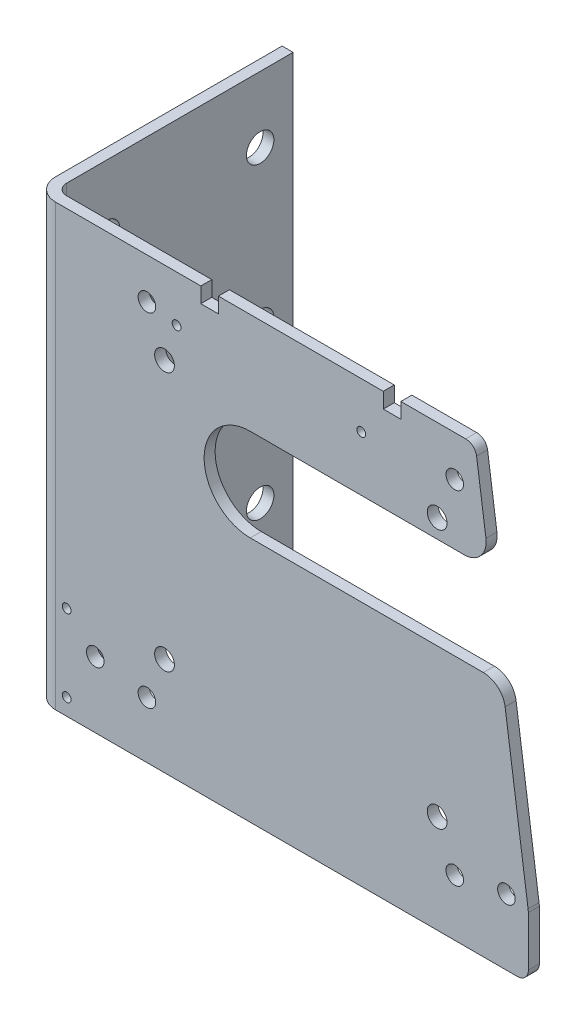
SolidWorks part; units mm, degrees
ref_plane "Plan de face" through (0, 0, 0) normal (0, 0, 1) x (1, 0, 0)
ref_plane "Plan de dessus" through (0, 0, 0) normal (0, 1, 0) x (1, 0, 0)
ref_plane "Plan de droite" through (0, 0, 0) normal (1, 0, 0) x (0, 0, -1)
sketch "Esquisse1" plane through (0, 0, 0) normal (0, 0, 1) x (1, 0, 0)
  line L0 (-121.5, 96.4) -> (-121.5, -103.6)
  line L1 (-121.5, 96.4) -> (-45.5, 96.4)
  line L2 (45.5, 96.4) -> (45.5, 89.4) construction
  line L3 (45.5, 89.4) -> (37.5, 89.4) construction
  line L4 (37.5, 89.4) -> (37.5, 96.4) construction
  line L5 (37.5, 96.4) -> (-37.5, 96.4) construction
  line L6 (-37.5, 96.4) -> (-37.5, 89.4) construction
  line L7 (-37.5, 89.4) -> (-45.5, 89.4) construction
  line L8 (-45.5, 89.4) -> (-45.5, 96.4) construction
  line L9 (45.5, 96.4) -> (45.5, 89.4)
  line L10 (45.5, 89.4) -> (37.5, 89.4)
  line L11 (37.5, 89.4) -> (37.5, 96.4)
  line L12 (37.5, 96.4) -> (-37.5, 96.4)
  line L13 (-37.5, 96.4) -> (-37.5, 89.4)
  line L14 (-37.5, 89.4) -> (-45.5, 89.4)
  line L15 (-45.5, 89.4) -> (-45.5, 96.4)
  line L16 (-121.5, -103.6) -> (98.4914, -103.6)
  line L17 (45.5, 96.4) -> (74.9805, 96.4)
  line L18 (103.5, -168.6) -> (103.5, -75.9496) construction
  line L19 (103.4513, -75.2538) -> (79.9319, 92.0959) construction
  line L20 (103.3552, -74.5698) -> (92.9044, -0.2083)
  line L21 (103.4914, -98.5914) -> (103.4525, -75.9444)
  line L22 (-22.994, 50.4) -> (74.2882, 50.4)
  line L23 (-22.994, 8.4) -> (83.0017, 8.4)
  line L24 (84.1909, 61.7917) -> (79.9319, 92.0959)
  arc A0 (74.9805, 96.4) -> (79.9319, 92.0959) centre (74.9805, 91.4) cw
  arc A1 (-22.994, 50.4) -> (-22.994, 8.4) centre (-22.994, 29.4) ccw
  arc A2 (74.2882, 50.4) -> (84.1909, 61.7917) centre (74.2882, 60.4) ccw
  arc A3 (92.9044, -0.2083) -> (83.0017, 8.4) centre (83.0017, -1.6) ccw
  arc A4 (103.3552, -74.5698) -> (103.4525, -75.9444) centre (93.4525, -75.9616) cw
  arc A5 (98.4914, -103.6) -> (103.4914, -98.5914) centre (98.4914, -98.6) ccw
  circle A6 centre (-62, -58.9) radius 4.5 construction
  circle A7 centre (62, -58.9) radius 4.5 construction
  circle A8 centre (62, 58.9) radius 4.5 construction
  circle A9 centre (-62, 58.9) radius 4.5 construction
  circle A10 centre (-62, -58.9) radius 4.5
  circle A11 centre (62, -58.9) radius 4.5
  circle A12 centre (62, 58.9) radius 4.5
  circle A13 centre (-62, 58.9) radius 4.5
  circle A14 centre (-70, 77.9) radius 4
  circle A15 centre (70, 77.9) radius 4
  circle A16 centre (93.5, -73.6) radius 4
  circle A17 centre (70, -77.9) radius 4
  circle A18 centre (-70, -77.9) radius 4
  circle A19 centre (-93.5, -73.6) radius 4
  point P26 (85.7919, 50.4)
  point P34 (103.5, -103.6)
  dimension "D2" = 5
  dimension "D4" = 42
  dimension "D5" = 10
  dimension "D6" = 5
  dimension "D7" = 8
  dimension "D8" = 8
  dimension "D9" = 8
  dimension "D10" = 8
  dimension "D11" = 8
  dimension "D12" = 8
  dimension "D1" = 200
  dimension "D3" = 225
extrude "Extrusion1" add sketch "Esquisse1" along normal blind 5
hole_wizard "Trou taraudé M4x0.71" positions "Esquisse3D1" profile "Esquisse2" tap size "M4x0.7" standard "ISO"
sketch3d "Esquisse3D1"
  line L0 (37.5, 96.4, 5) -> (-37.5, 96.4, 5) construction
  line L1 (-121.5, 96.4, 5) -> (-121.5, -103.6, 5) construction
  line L2 (-121.5, -103.6, 5) -> (98.4914, -103.6, 5) construction
  point P0 (-56.5, 75.4, 5)
  point P2 (27.5, 75.4, 5)
  point P4 (-106.5, -61.1, 5)
  point P6 (-106.5, -96.1, 5)
  dimension "D1" = 84
  dimension "D2" = 21
  dimension "D3" = 65
  dimension "D4" = 35
  dimension "D5" = 7.5
  dimension "D6" = 15
sketch "Esquisse2" plane through (-56.5, 75.4, 5) normal (1, 0, 0) x (0, -1, 0)
  line L0 (0, 0) -> (0, 11.0914)
  line L1 (0, 11.0914) -> (1.65, 10.1)
  line L2 (1.65, 10.1) -> (1.65, 8)
  line L3 (1.65, 8) -> (2, 8)
  line L4 (2, 8) -> (2, 0)
  line L5 (2, 0) -> (0, 0)
  line L10 (0, 11.0914) -> (-1.65, 10.1) construction
  line L11 (0, -6.35) -> (0, 107.95) construction
  dimension "Diamètre du trou pour taraudage" = 3.3
  dimension "Profondeur du trou pour taraudage" = 10.1
  dimension "Diamètre principal du filetage" = 4
  dimension "Profondeur du filetage" = 8
  dimension "Angle de pointe" = 118
sketch "Esquisse3" plane through (0, 0, 5) normal (0, 0, 1) x (1, 0, 0)
  line L0 (-121.5, -103.6) -> (98.4914, -103.6) construction
  line L1 (-121.5, 96.4) -> (-116.5, 96.4)
  line L2 (-121.5, 96.4) -> (-121.5, -103.6)
  line L3 (-121.5, -103.6) -> (-116.5, -103.6)
  line L4 (-116.5, 96.4) -> (-116.5, -103.6)
  dimension "D1" = 5
extrude "Extrusion2" add sketch "Esquisse3" against normal blind 113
fillet "Congé1" radius 10 1 edges at (-121.5, -3.6, 5)
fillet "Congé2" radius 5 1 edges at (-116.5, -3.6, 0)
sketch "Esquisse4" plane through (-121.5, 0, 0) normal (-1, 0, 0) x (0, 0, 1)
  line L0 (-5, 96.4) -> (-108, 96.4) construction
  line L1 (-108, 96.4) -> (-108, -103.6) construction
  circle A0 centre (-93, -73.6) radius 6.25
  circle A1 centre (-93, -3.6) radius 6.25
  circle A2 centre (-93, 66.4) radius 6.25
  circle A3 centre (-23, -3.6) radius 6.25
  circle A4 centre (-23, -73.6) radius 6.25
  circle A5 centre (-23, 66.4) radius 6.25
  dimension "D1" = 12.5
  dimension "D2" = 12.5
  dimension "D3" = 12.5
  dimension "D4" = 12.5
  dimension "D5" = 12.5
  dimension "D6" = 12.5
  dimension "D7" = 70
  dimension "D8" = 15
  dimension "D9" = 70
  dimension "D10" = 70
  dimension "D11" = 100
extrude "Enlèv. mat.-Extru.1" cut sketch "Esquisse4" against normal through all
